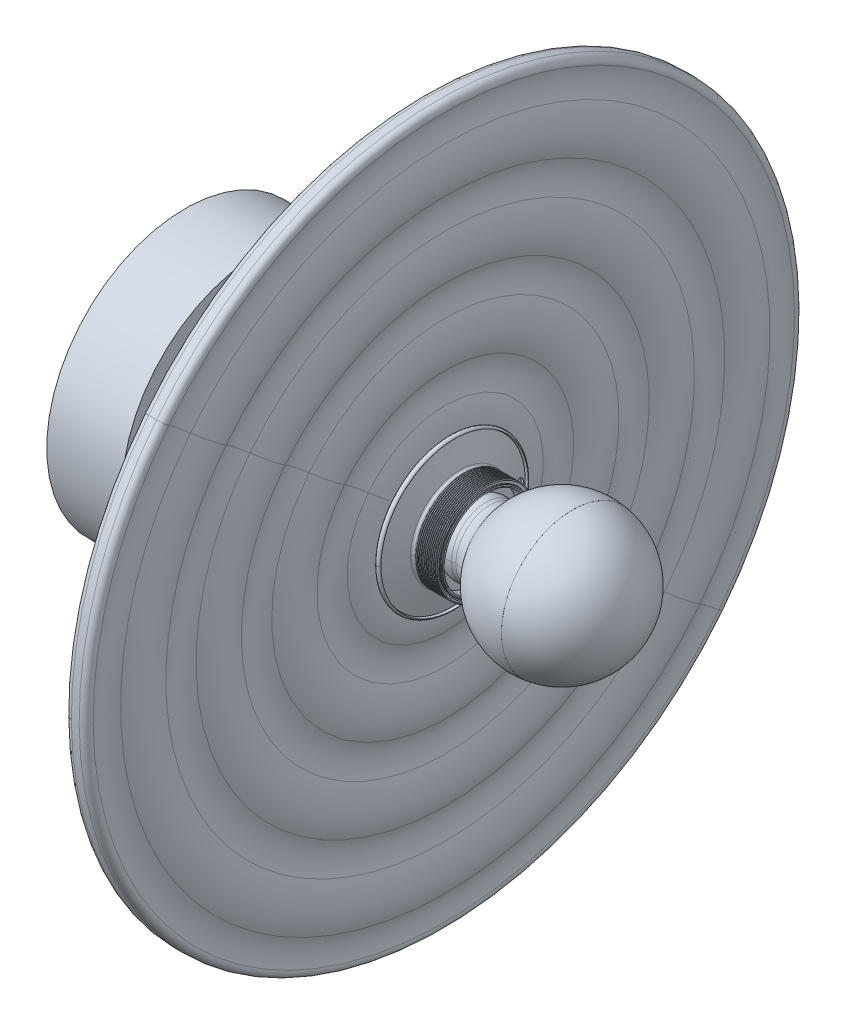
SolidWorks part; units mm, degrees
ref_plane "Alzado" through (0, 0, 0) normal (0, 0, 1) x (1, 0, 0)
ref_plane "Planta" through (0, 0, 0) normal (0, 1, 0) x (1, 0, 0)
ref_plane "Vista lateral" through (0, 0, 0) normal (1, 0, 0) x (0, 0, -1)
imported_body "1094-30 (1).IGS<1>"
ref_plane "Plano1" through (-50, 0, 0) normal (1, 0, 0) x (0, 0, -1)
sketch "Croquis2" plane through (-50, 0, 0) normal (1, 0, 0) x (0, 0, -1)
  circle A0 centre (-160.9671, 2.9755) radius 54.991
  dimension "D1" = 109.982
extrude "Saliente-Extruir1" add sketch "Croquis2" against normal blind 29.972
